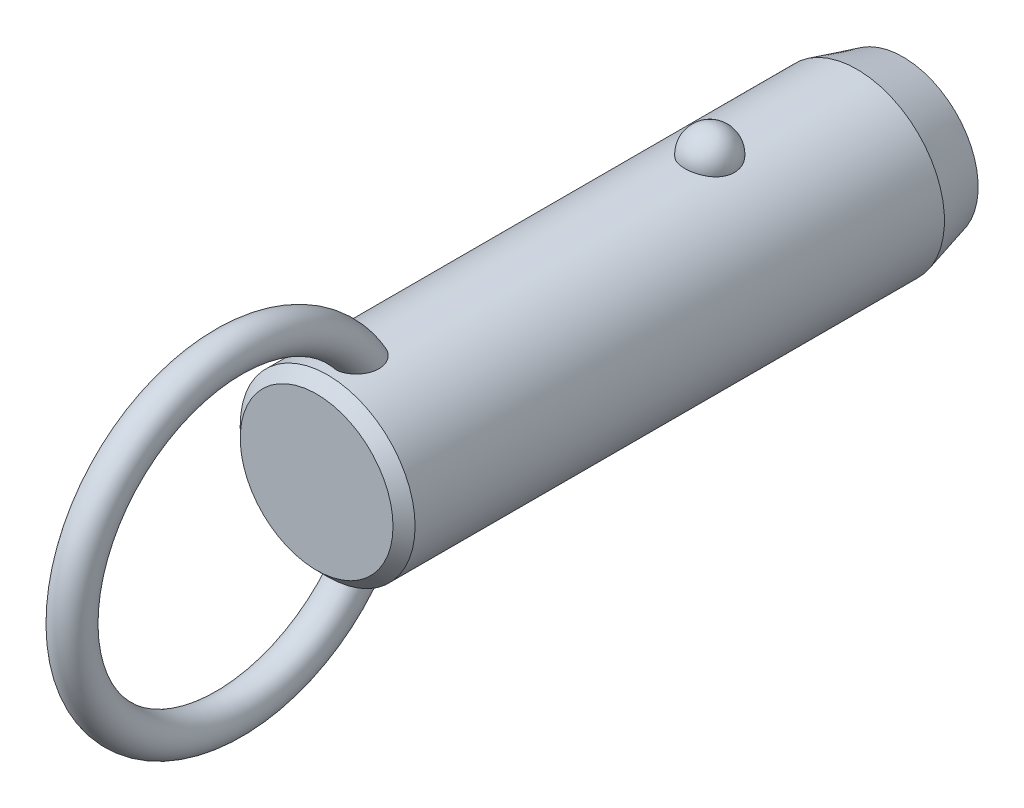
SolidWorks part; units mm, degrees
ref_plane "Front Plane" through (0, 0, 0) normal (0, 0, 1) x (1, 0, 0)
ref_plane "Top Plane" through (0, 0, 0) normal (0, 1, 0) x (1, 0, 0)
ref_plane "Right Plane" through (0, 0, 0) normal (1, 0, 0) x (0, 0, -1)
sketch "Sketch2" plane through (0, 0, 0) normal (0, 0, 1) x (1, 0, 0)
  circle A0 centre (0, 0) radius 9.5
  point P3 (0, 9.5)
  dimension "D1" = 19
extrude "Boss-Extrude1" add sketch "Sketch2" along normal blind 30.5
sketch "Sketch3" plane through (0, 0, 0) normal (0, 0, -1) x (-1, 0, 0)
  circle A0 centre (0, 0) radius 9.5
  dimension "D1" = 19
extrude "Boss-Extrude2" add sketch "Sketch3" along normal blind 23.7
chamfer "Chamfer1" distance 5 angle 15 1 edges at (-9.5, 0, -23.7)
sketch "Sketch12" plane through (0, 0, 0) normal (1, 0, 0) x (0, 0, -1)
  line L0 (-30.5, 9.5) -> (-30.5, -9.5) construction
  point P0 (-30.5, 0)
sketch "Sketch13" plane through (0, 0, 0) normal (1, 0, 0) x (0, 0, -1)
  circle A0 centre (-49.55, 0) radius 19.05
  point P2 (-30.5, 0)
  dimension "D1" = 38.1
sketch "Sketch14" plane through (0, 0, 0) normal (0, 1, 0) x (1, 0, 0)
  circle A0 centre (0, -32.5) radius 2
  point P2 (0, -30.5)
  dimension "D1" = 4
sweep "Sweep1" add profiles "Sketch14" path "Sketch13"
sketch "Sketch15" plane through (0, 0, 30.5) normal (0, 0, 1) x (1, 0, 0)
  circle A0 centre (0, 0) radius 9.5
  dimension "D1" = 19
extrude "Boss-Extrude3" add sketch "Sketch15" along normal blind 9.52
chamfer "Chamfer2" distance 1.2 angle 45 1 edges at (9.5, 0, 40.02)
sketch "Sketch18" plane through (0, 0, 0) normal (1, 0, 0) x (0, 0, -1)
  line L0 (18.7, 9.5) -> (-33.0378, 9.5) construction
  line L1 (2.7, 12.2) -> (2.7, 6.8)
  line L2 (-33.0378, -9.5) -> (18.7, -9.5) construction
  arc A0 (2.7, 12.2) -> (2.7, 6.8) centre (2.7, 9.5) ccw
  point P4 (0, 9.5)
  dimension "D1" = 21.7
revolve "Revolve1" add sketch "Sketch18" angle 360 about L1
